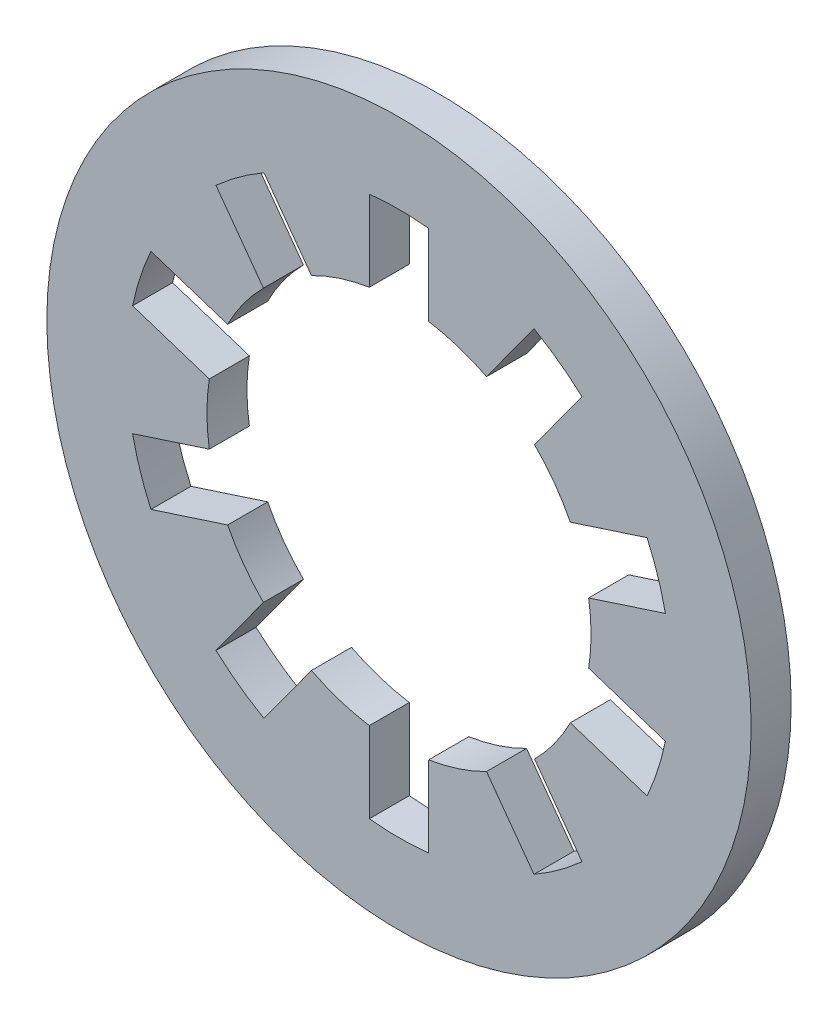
SolidWorks part; units mm, degrees
ref_plane "Front Plane" through (0, 0, 0) normal (0, 0, 1) x (1, 0, 0)
ref_plane "Top Plane" through (0, 0, 0) normal (0, 1, 0) x (1, 0, 0)
ref_plane "Right Plane" through (0, 0, 0) normal (1, 0, 0) x (0, 0, -1)
sketch "Sketch1" plane through (0, 0, 0) normal (0, 0, 1) x (1, 0, 0)
  circle A0 centre (0, 0) radius 2.2
  circle A1 centre (0, 0) radius 1.2
  dimension "B" = 4.4
  dimension "A" = 2.4
extrude "Extrude1" add sketch "Sketch1" along normal blind 0.25
sketch "Sketch2" plane through (0, 0, 0) normal (0, 0, 1) x (1, 0, 0)
  line L0 (0, 0) -> (0.5253, 1.6168) construction
  line L1 (0, 0) -> (0, 1.7) construction
  line L2 (0, 0) -> (-0.5253, 1.6168) construction
  line L3 (-0.3708, 1.1413) -> (0, 1.1413) construction
  line L4 (-0.1854, 1.6899) -> (-0.1854, 1.1856)
  line L5 (0.1854, 1.6899) -> (0.1854, 1.1856)
  line L6 (-0.1854, 1.1856) -> (0.1854, 1.1856)
  circle A0 centre (0, 0) radius 1.2 construction
  circle A1 centre (0, 0) radius 1.2 construction
  arc A2 (0.1854, 1.6899) -> (-0.1854, 1.6899) centre (0, 0) ccw
  dimension "D1" = 3.4
  dimension "D2" = 18
  dimension "D3" = 18
extrude "Cut-Extrude1" cut sketch "Sketch2" along normal through all
pattern_circular "CirPattern1" count 10 over 360 about axis through (0, 0, 0) along (0, 0, 1) of "Cut-Extrude1"
sketch "Sketch3" plane through (0, 0, 0) normal (0, 0, 1) x (1, 0, 0)
  line L0 (0, 0) -> (0, 1.7) construction
  line L1 (0, 0) -> (0.5814, 1.5975) construction
  line L2 (0, 0) -> (-0.5814, 1.5975) construction
  line L3 (-0.4104, 1.1276) -> (0, 1.1276) construction
  line L4 (0.2052, 1.6876) -> (0.2052, 1.1823)
  line L5 (-0.2052, 1.6876) -> (-0.2052, 1.1823)
  line L6 (-0.2052, 1.1823) -> (0.2052, 1.1823)
  circle A0 centre (0, 0) radius 1.2 construction
  circle A1 centre (0, 0) radius 1.2 construction
  arc A2 (0.2052, 1.6876) -> (-0.2052, 1.6876) centre (0, 0) ccw
  circle A3 centre (0, 0) radius 1.2 construction
  dimension "D1" = 3.4
  dimension "D2" = 20
  dimension "D3" = 20
extrude "Cut-Extrude2" [suppressed] cut sketch "Sketch3" along normal through all
pattern_circular "CirPattern2" [suppressed] count 9 over 360
equation "\"D1@Sketch2\" =  ( \"A@Sketch1\" + \"B@Sketch1\" )  / 2"
equation "\"D1@Sketch3\" =  ( \"A@Sketch1\" + \"B@Sketch1\" )  / 2"
